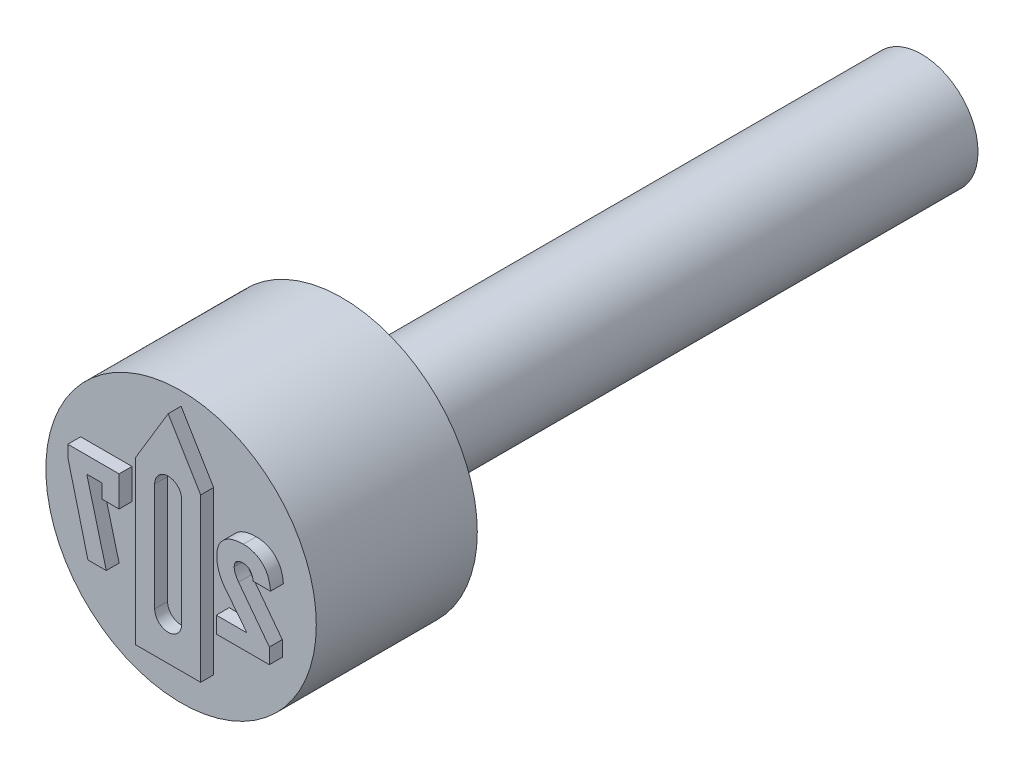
SolidWorks part; units mm, degrees
ref_plane "Front Plane" through (0, 0, 0) normal (0, 0, 1) x (1, 0, 0)
ref_plane "Top Plane" through (0, 0, 0) normal (0, 1, 0) x (1, 0, 0)
ref_plane "Right Plane" through (0, 0, 0) normal (1, 0, 0) x (0, 0, -1)
sketch "Sketch2" plane through (0, 0, 0) normal (1, 0, 0) x (0, 0, -1)
  line L0 (0.4039, 0) -> (50000.4039, 0) construction
  line L6 (0, 4.2) -> (0, 0)
  line L7 (5, 4.2) -> (0, 4.2)
  line L8 (5, 1.75) -> (5, 4.2)
  line L9 (23, 1.75) -> (5, 1.75)
  line L10 (23, 0) -> (23, 1.75)
  line L11 (0, 0) -> (23, 0)
  dimension "D1" = 8.4
  dimension "D2" = 3.5
  dimension "D3" = 23
  dimension "D4" = 5
revolve "Revolve1" add sketch "Sketch2" angle 360 about L0
sketch "Sketch3" plane through (0, 0, 0) normal (0, 0, 1) x (1, 0, 0)
  line L0 (0, -0.8) -> (0, 192374.2) construction
  line L1 (-1.01, -2.94) -> (1.01, -2.94)
  line L2 (1.01, -2.94) -> (1.01, 2.1)
  line L3 (1.01, 2.1) -> (0, 3.7809)
  line L4 (0, 3.7809) -> (-1.01, 2.1)
  line L5 (-1.01, 2.1) -> (-1.01, -2.94)
  text T0 "2    7" font "Bahnschrift" height 2.8
  dimension "D1" = 2.02
  dimension "D2" = 1.01
  dimension "D3" = 5.04
  dimension "D4" = 62
  dimension "D5" = 2.94
  dimension "D6" = 1.4
  dimension "D7" = 3.35
extrude "Boss-Extrude1" add sketch "Sketch3" along normal blind 0.4
sketch "Sketch4" plane through (0, 0, 0.4) normal (0, 0, 1) x (1, 0, 0)
  line L2 (-0.42, 1.68) -> (-0.42, -1.68)
  line L4 (0.42, 1.68) -> (0.42, -1.68)
  arc A0 (0.42, 1.68) -> (-0.42, 1.68) centre (0, 1.68) ccw
  arc A1 (-0.42, -1.68) -> (0.42, -1.68) centre (0, -1.68) ccw
  dimension "D1" = 0.84
  dimension "D2" = 0.42
  dimension "D3" = 3.36
  dimension "D4" = 1.68
extrude "Cut-Extrude1" cut sketch "Sketch4" against normal blind 0.4
